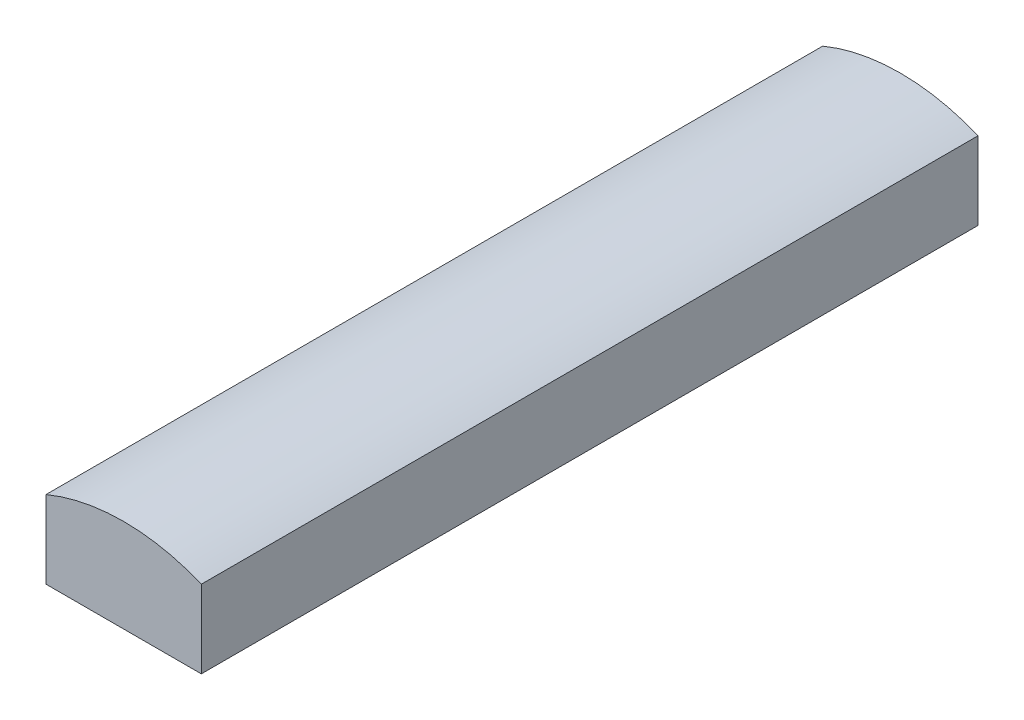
SolidWorks part; units mm, degrees
ref_plane "Vorne" through (0, 0, 0) normal (0, 0, 1) x (1, 0, 0)
ref_plane "Oben" through (0, 0, 0) normal (0, 1, 0) x (1, 0, 0)
ref_plane "Rechts" through (0, 0, 0) normal (1, 0, 0) x (0, 0, -1)
sketch "Skizze1" plane through (0, 0, 0) normal (0, 0, 1) x (1, 0, 0)
  line L0 (50, 0) -> (50, 50) construction
  line L1 (-50, 0) -> (50, 0) construction
  line L2 (-50, 50) -> (-50, 0) construction
  line L3 (50, 0) -> (50, 50)
  line L4 (-50, 0) -> (50, 0)
  line L5 (-50, 50) -> (-50, 0)
  arc A0 (-50, 50) -> (50, 50) centre (0, -70) cw
  dimension "D1" = 60
extrude "Linear austragen1" add sketch "Skizze1" against normal blind 500.1
sketch "Skizze3" plane through (0, 0, 0) normal (0, -1, 0) x (1, 0, 0)
  circle A0 centre (-9.7086, -27.3838) radius 0.05
  dimension "D1" = 0.1
extrude "Linear austragen2" add sketch "Skizze3" along normal blind 0.1
sketch "Skizze4" plane through (0, 0, -500.1) normal (0, 0, -1) x (-1, 0, 0)
  line L3 (-50, 0) -> (50, 0)
  line L4 (50, 0) -> (50, 50)
  line L5 (-50, 50) -> (-50, 0)
  line L6 (-50, 0) -> (50, 0)
  line L7 (50, 0) -> (50, 50)
  line L8 (-50, 50) -> (-50, 0)
  arc A1 (50, 50) -> (-50, 50) centre (0, -70) ccw
  arc A2 (50, 50) -> (-50, 50) centre (0, -70) ccw
  dimension "D1" = 0
extrude "Schnitt-Linear austragen1" cut sketch "Skizze4" against normal up to surface (0.1 mm away)
